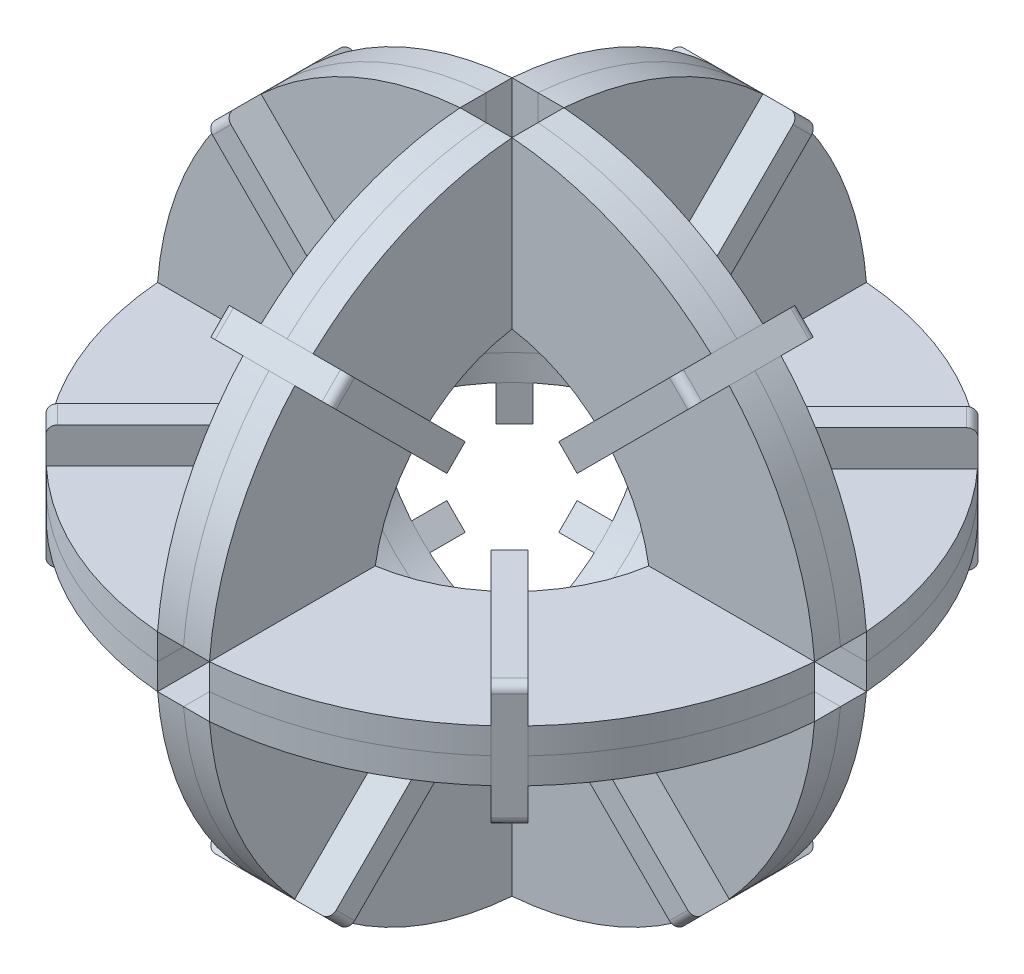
SolidWorks part; units mm, degrees
ref_plane "Front Plane" through (0, 0, 0) normal (0, 0, 1) x (1, 0, 0)
ref_plane "Top Plane" through (0, 0, 0) normal (0, 1, 0) x (1, 0, 0)
ref_plane "Right Plane" through (0, 0, 0) normal (1, 0, 0) x (0, 0, -1)
sketch3d "3DSketch1"
  line L5 (50.8, 0, 0) -> (0, 50.8, 0)
  line L6 (0, 0, -50.8) -> (50.8, 0, 0)
  line L14 (0, 0, -50.8) -> (-50.8, 0, 0)
  line L15 (-50.8, 0, 0) -> (0, 0, 50.8)
  line L16 (50.8, 0, 0) -> (0, 0, 50.8)
  line L17 (0, 0, -50.8) -> (0, 0, 50.8) construction
  line L18 (-50.8, 0, 0) -> (50.8, 0, 0) construction
  line L19 (0, 50.8, 0) -> (0, 0, 50.8)
  line L20 (0, 50.8, 0) -> (0, 0, -50.8)
  line L21 (-50.8, 0, 0) -> (0, 50.8, 0)
  line L22 (-50.8, 0, 0) -> (0, -50.8, 0)
  line L23 (0, -50.8, 0) -> (0, 0, -50.8)
  line L24 (0, -50.8, 0) -> (0, 0, 50.8)
  line L25 (50.8, 0, 0) -> (0, -50.8, 0)
  point P0 (0, 0, 0)
sketch "Sketch1" plane through (0, 0, 0) normal (0, 1, 0) x (1, 0, 0)
  line L0 (0, 0) -> (0, -50.8) construction
  line L1 (0, 50.8) -> (0, -50.8) construction
  line L2 (0, 50.8) -> (0, -50.8)
  arc A0 (0, 50.8) -> (0, -50.8) centre (0, 0) cw
sketch "Sketch2" plane through (0, 0, 0) normal (0, 0, 1) x (1, 0, 0)
  circle A0 centre (0, 0) radius 50.8
sketch "Sketch3" plane through (0, 0, 0) normal (1, 0, 0) x (0, 0, -1)
  circle A0 centre (0, 0) radius 50.8
sketch "Sketch4" plane through (0, 0, 0) normal (0, 1, 0) x (1, 0, 0)
  line L0 (0, 50.8) -> (0, -50.8) construction
  circle A0 centre (0, 0) radius 50.8
sketch "Sketch6" plane through (0, 0, 0) normal (1, 0, 0) x (0, 0, -1)
  line L0 (0, 50.8) -> (-50.8, 0) construction
  line L1 (-25.4, 0) -> (-50.8, 0) construction
  line L2 (0, 50.8) -> (0, 25.4) construction
  line L5 (50.8, 0) -> (-50.8, 0) construction
  line L6 (-4, 50.6423) -> (-4, 25.0831)
  line L7 (-25.0831, 4) -> (-50.6423, 4)
  arc A0 (-50.8, 0) -> (0, 50.8) centre (0, 0) cw construction
  arc A1 (-25.4, 0) -> (0, 25.4) centre (0, 0) cw construction
  arc A2 (-50.6423, 4) -> (-4, 50.6423) centre (0, 0) cw
  arc A3 (-25.0831, 4) -> (-4, 25.0831) centre (0, 0) cw
extrude "Boss-Extrude2" add sketch "Sketch6" along normal blind 4 separate body
sketch "Sketch7" plane through (0, 0, 0) normal (0, 1, 0) x (1, 0, 0)
  line L0 (0, 50.8) -> (0, -50.8) construction
  line L1 (-50.8, 0) -> (0, -50.8) construction
  line L2 (0, -25.4) -> (0, -50.8) construction
  line L3 (25.4, 0) -> (50.8, 0) construction
  line L4 (4, -25.0831) -> (4, -50.6423)
  line L5 (25.0831, -4) -> (50.6423, -4)
  arc A0 (50.8, 0) -> (0, -50.8) centre (0, 0) cw construction
  arc A1 (25.4, 0) -> (0, -25.4) centre (0, 0) cw construction
  arc A2 (4, -25.0831) -> (25.0831, -4) centre (0, 0) ccw
  arc A3 (4, -50.6423) -> (50.6423, -4) centre (0, 0) ccw
extrude "Boss-Extrude3" add sketch "Sketch7" along normal blind 4 separate body
sketch "Sketch5" plane through (0, 0, 0) normal (0, 0, 1) x (1, 0, 0)
  line L0 (0, 50.8) -> (0, 25.4) construction
  line L1 (25.4, 0) -> (50.8, 0) construction
  line L4 (-50.8, 0) -> (50.8, 0) construction
  line L5 (4, 50.6423) -> (4, 25.0831)
  line L6 (25.0831, 4) -> (50.6423, 4)
  arc A0 (0, 50.8) -> (50.8, 0) centre (0, 0) cw construction
  circle A1 centre (0, 0) radius 50.8 construction
  arc A2 (0, 25.4) -> (25.4, 0) centre (0, 0) cw construction
  arc A3 (4, 25.0831) -> (25.0831, 4) centre (0, 0) cw
  arc A4 (4, 50.6423) -> (50.6423, 4) centre (0, 0) cw
extrude "Boss-Extrude1" add sketch "Sketch5" along normal blind 4
sketch "Sketch8" plane through (4, 0, 0) normal (1, 0, 0) x (0, 0, -1)
  line L0 (0, 0) -> (-47.7364, 17.3746) construction
  line L1 (0, 0) -> (-35.921, 35.921) construction
  line L2 (-47.1447, 19.0003) -> (-48.3281, 15.749) construction
  line L3 (-47.1447, 19.0003) -> (-35.2106, 14.6566) construction
  line L4 (-48.3281, 15.749) -> (-36.394, 11.4053) construction
  line L5 (-35.2106, 14.6566) -> (-36.394, 11.4053) construction
  line L6 (0, 0) -> (-50.8, 0) construction
  line L7 (-15.749, 48.3281) -> (-11.4053, 36.394) construction
  line L8 (-14.6566, 35.2106) -> (-11.4053, 36.394) construction
  line L9 (-19.0003, 47.1447) -> (-14.6566, 35.2106) construction
  line L10 (-19.0003, 47.1447) -> (-15.749, 48.3281) construction
  line L11 (-37.1443, 34.6977) -> (-34.6977, 37.1443)
  line L12 (-37.1443, 34.6977) -> (-28.1641, 25.7175)
  line L13 (-34.6977, 37.1443) -> (-25.7175, 28.1641)
  line L14 (-28.1641, 25.7175) -> (-25.7175, 28.1641)
  arc A0 (-4, 50.6423) -> (-50.6423, 4) centre (0, 0) ccw construction
  point P18 (-35.921, 35.921)
extrude "Cut-Extrude1" cut sketch "Sketch8" against normal through all
sketch "Sketch9" plane through (0, 0, 4) normal (0, 0, 1) x (1, 0, 0)
  line L0 (0, 0) -> (35.921, 35.921) construction
  line L1 (0, 0) -> (50.8, 0) construction
  line L2 (34.6977, 37.1443) -> (37.1443, 34.6977)
  line L3 (34.6977, 37.1443) -> (25.7175, 28.1641)
  line L4 (37.1443, 34.6977) -> (28.1641, 25.7175)
  line L5 (25.7175, 28.1641) -> (28.1641, 25.7175)
  arc A0 (50.6423, 4) -> (4, 50.6423) centre (0, 0) ccw construction
  point P5 (35.921, 35.921)
extrude "Cut-Extrude2" cut sketch "Sketch9" against normal through all
sketch "Sketch10" plane through (0, 4, 0) normal (0, 1, 0) x (1, 0, 0)
  line L0 (0, 0) -> (35.921, -35.921) construction
  line L1 (0, 0) -> (0, -50.8) construction
  line L2 (37.1443, -34.6977) -> (34.6977, -37.1443)
  line L3 (37.1443, -34.6977) -> (28.1641, -25.7175)
  line L4 (34.6977, -37.1443) -> (25.7175, -28.1641)
  line L5 (28.1641, -25.7175) -> (25.7175, -28.1641)
  arc A0 (0, -50.8) -> (0, 50.8) centre (0, 0) ccw construction
  point P15 (35.921, -35.921)
extrude "Cut-Extrude3" cut sketch "Sketch10" against normal through all
pattern_circular "CirPattern2" count 4 over 360 about axis through (0, 0, 0) along (0, 1, 0)
mirror "Mirror2" about plane through (0, 0, 0) normal (0, 1, 0)
sketch "Sketch11" plane through (0, 1.2233, -1.2233) normal (0, -0.7071, 0.7071) x (1, 0, 0)
  line L0 (-3.714, 38.1) -> (3.714, 38.1)
  line L4 (-3.714, 38.1) -> (-3.714, 25.4)
  line L5 (-3.714, 25.4) -> (-9.525, 25.4)
  line L6 (-9.525, 25.4) -> (-9.525, 50.8)
  line L7 (-9.525, 50.8) -> (9.525, 50.8)
  line L8 (9.525, 50.8) -> (9.525, 25.4)
  line L9 (9.525, 25.4) -> (3.714, 25.4)
  line L10 (3.714, 25.4) -> (3.714, 38.1)
  point P4 (0, 38.1)
extrude "Boss-Extrude4" add sketch "Sketch11" along normal blind 4 separate body
sketch "Sketch13" plane through (1.2233, 0, -1.2233) normal (-0.7071, 0, 0.7071) x (0.7071, 0, 0.7071)
  line L0 (38.1, 3.46) -> (38.1, -3.46)
  line L2 (38.1, -3.46) -> (25.4, -3.46)
  line L3 (25.4, -3.46) -> (25.4, -9.525)
  line L4 (25.4, -9.525) -> (50.8, -9.525)
  line L5 (50.8, -9.525) -> (50.8, 9.525)
  line L6 (50.8, 9.525) -> (25.4, 9.525)
  line L7 (25.4, 9.525) -> (25.4, 3.46)
  line L8 (25.4, 3.46) -> (38.1, 3.46)
  point P4 (38.1, 0)
extrude "Boss-Extrude5" add sketch "Sketch13" along normal blind 4 separate body
fillet "Fillet1" radius 1.27 2 edges at (9.525, 35.7301, 36.1119) (-9.525, 35.7301, 36.1119)
fillet "Fillet2" radius 1.27 2 edges at (35.7301, -9.525, 36.1119) (35.7301, 9.525, 36.1119)
pattern_circular "CirPattern3" count 4 over 360 about axis through (0, 0, 0) along (0, 1, 0)
mirror "Mirror4" about plane through (0, 0, 0) normal (0, 1, 0)
fillet "Fillet3" radius 1.27 2 edges at (3.714, 17.7696, 18.1514) (-3.714, 17.7696, 18.1514)
equation "\"STRIP_THICKNESS\"= 4mm"
equation "\"STRIP_WIDTH\"=1"
equation "\"D1@Sketch5\"=\"STRIP_WIDTH\""
equation "\"D1@Boss-Extrude1\"=\"STRIP_THICKNESS\""
equation "\"D1@Sketch6\"=\"STRIP_WIDTH\""
equation "\"D1@Boss-Extrude2\"=\"STRIP_THICKNESS\""
equation "\"D1@Sketch7\"=\"STRIP_WIDTH\""
equation "\"D1@Boss-Extrude3\"=\"STRIP_THICKNESS\""
equation "\"ANG_OFFSET\"= 4"
equation "\"D2@Sketch5\"=\"STRIP_THICKNESS\""
equation "\"D3@Sketch6\"=\"STRIP_THICKNESS\""
equation "\"D2@Sketch6\"=\"STRIP_THICKNESS\""
equation "\"D2@Sketch7\"=\"STRIP_THICKNESS\""
equation "\"D3@Sketch7\"=\"STRIP_THICKNESS\""
equation "\"SLOT_WIDTH\"= 3.46mm"
equation "\"D1@Sketch8\"=\"SLOT_WIDTH\""
equation "\"SLOT_DEPTH\"=0.5"
equation "\"D3@Sketch8\"=\"SLOT_DEPTH\""
equation "\"D2@Sketch9\"=\"SLOT_DEPTH\""
equation "\"D3@Sketch9\"=\"SLOT_WIDTH\""
equation "\"D2@Sketch10\"=\"SLOT_DEPTH\""
equation "\"D3@Sketch10\"=\"SLOT_WIDTH\""
equation "\"DIAMETER\"= 4"
equation "\"D1@3DSketch1\"=\"DIAMETER\""
equation "\"D3@Sketch5\"=\"STRIP_THICKNESS\""
equation "\"D1@Sketch11\"=\"SLOT_WIDTH\"*2+.02"
equation "\"D3@Sketch11\"=\"SLOT_DEPTH\""
equation "\"CONNECTOR_WIDTH\"=0.75"
equation "\"D4@Sketch11\"=\"CONNECTOR_WIDTH\""
equation "\"D1@Boss-Extrude4\"=\"STRIP_THICKNESS\""
equation "\"D2@Sketch11\"=\"STRIP_WIDTH\""
equation "\"D1@Sketch13\"=\"SLOT_DEPTH\""
equation "\"D2@Sketch13\"=\"SLOT_WIDTH\"*2"
equation "\"D1@Boss-Extrude5\"=\"STRIP_THICKNESS\""
equation "\"D3@Sketch13\"=\"STRIP_WIDTH\""
equation "\"D4@Sketch13\"=\"CONNECTOR_WIDTH\""
